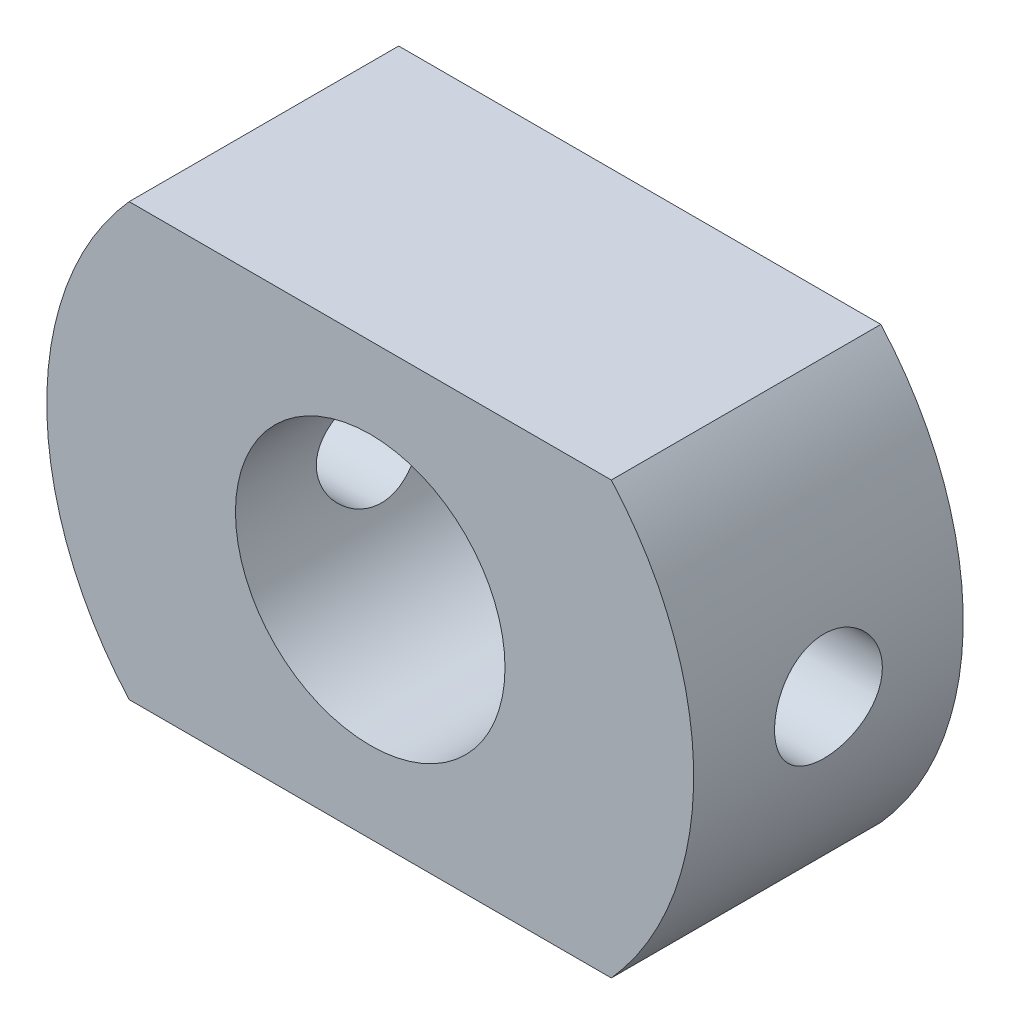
SolidWorks part; units mm, degrees
ref_plane "Face" through (0, 0, 0) normal (0, 0, 1) x (1, 0, 0)
ref_plane "Dessus" through (0, 0, 0) normal (0, 1, 0) x (1, 0, 0)
ref_plane "Droite" through (0, 0, 0) normal (1, 0, 0) x (0, 0, -1)
sketch "Esquisse1" plane through (0, 0, 0) normal (0, 0, 1) x (1, 0, 0)
  line L0 (-7.3361, 0) -> (8.1997, 0) construction
  line L1 (-4.4721, 4) -> (4.4721, 4)
  line L2 (-4.4721, -4) -> (4.4721, -4)
  arc A0 (-4.4721, 4) -> (-4.4721, -4) centre (0, 0) ccw
  circle A1 centre (0, 0) radius 2.5
  arc A2 (4.4721, -4) -> (4.4721, 4) centre (0, 0) ccw
  dimension "D1" = 12
  dimension "D2" = 5
  dimension "D3" = 8
extrude "Base-Extrusion" add sketch "Esquisse1" along normal blind 5
sketch "Esquisse2" plane through (0, 0, 0) normal (1, 0, 0) x (0, 0, -1)
  line L0 (0.923, 0) -> (-6.7303, 0) construction
  line L1 (-5, 0) -> (0, 0) construction
  line L2 (0, -4) -> (0, 4) construction
  circle A0 centre (-2.5, 0) radius 1
  dimension "D1" = 2
  dimension "D2" = 2.5
extrude "Enlèv. mat.-Extru.1" cut sketch "Esquisse2" against normal through all and the other way through all
